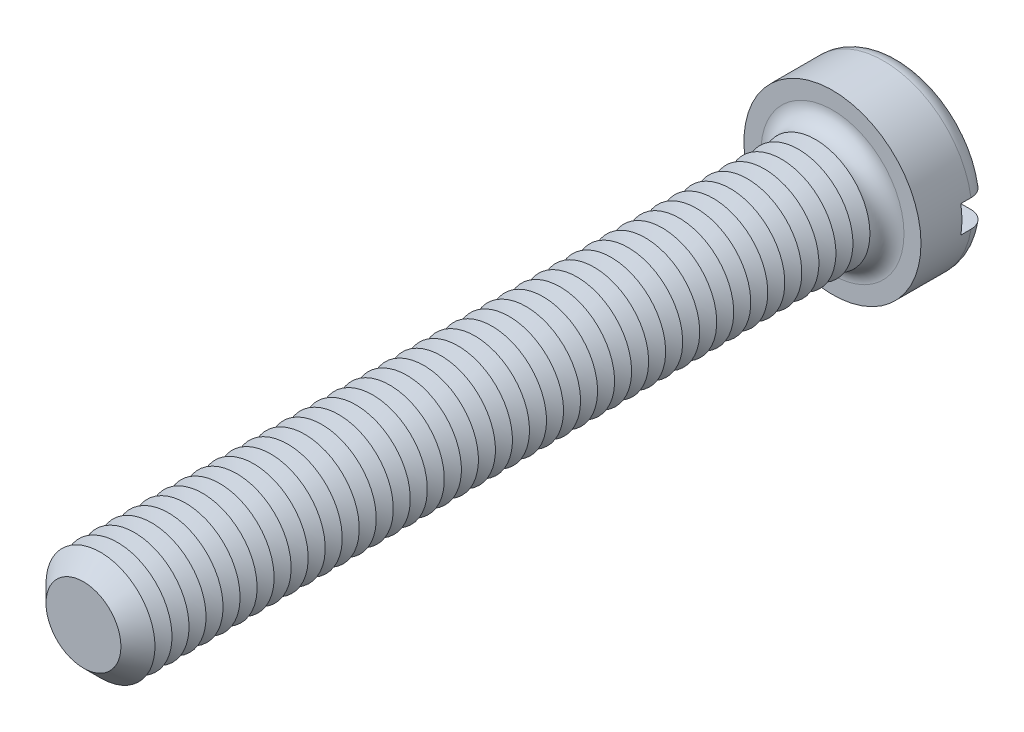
SolidWorks part; units mm, degrees
ref_plane "Front Plane" through (0, 0, 0) normal (0, 0, 1) x (1, 0, 0)
ref_plane "Top Plane" through (0, 0, 0) normal (0, 1, 0) x (1, 0, 0)
ref_plane "Right Plane" through (0, 0, 0) normal (1, 0, 0) x (0, 0, -1)
sketch "Sketch3" plane through (0, 0, 0) normal (0, 0, 1) x (1, 0, 0)
  circle A0 centre (0, 0) radius 6.5
  dimension "D1" = 13
extrude "Boss-Extrude2" add sketch "Sketch3" against normal blind 5
sketch "Sketch4" plane through (0, 0, 0) normal (0, 0, 1) x (1, 0, 0)
  circle A0 centre (0, 0) radius 4
  dimension "D1" = 8
extrude "Boss-Extrude3" add sketch "Sketch4" along normal blind 55
fillet "Fillet1" radius 1.25 2 edges at (6.5, 0, -5) (4, 0, 0)
chamfer "Chamfer1" distance 1.25 angle 45 1 edges at (4, 0, 55)
sketch "Sketch5" plane through (0, 0, 0) normal (1, 0, 0) x (0, 0, -1)
  line L0 (1.6944, 0) -> (-7.6738, 0) construction
sketch "Sketch6" plane through (0, 0, 0) normal (1, 0, 0) x (0, 0, -1)
  line L0 (-1.25, 4) -> (-1.875, 2.9175)
  line L1 (-1.875, 2.9175) -> (-2.5, 4)
  line L2 (-1.25, 4) -> (-53.75, 4) construction
  line L3 (-2.5, 4) -> (-1.25, 4)
  dimension "D1" = 1.25
revolve "Cut-Revolve1" cut sketch "Sketch6" angle 360 about L0
pattern_linear "LPattern1" count 42 spacing 1.25 along (0, 0, 1) of "Cut-Revolve1"
sketch "Sketch8" plane through (0, 0, -5) normal (0, 0, -1) x (-1, 0, 0)
  line L1 (6.5, -1) -> (-6.5, -1)
  line L2 (6.5, -1) -> (6.5, 1)
  line L3 (6.5, 1) -> (-6.5, 1)
  line L4 (-6.5, -1) -> (-6.5, 1)
  line L5 (6.5, -1) -> (-6.5, 1) construction
  line L6 (6.5, 1) -> (-6.5, -1) construction
  point P0 (0, 0)
  dimension "D1" = 13
  dimension "D2" = 2
extrude "Cut-Extrude1" cut sketch "Sketch8" against normal blind 2
